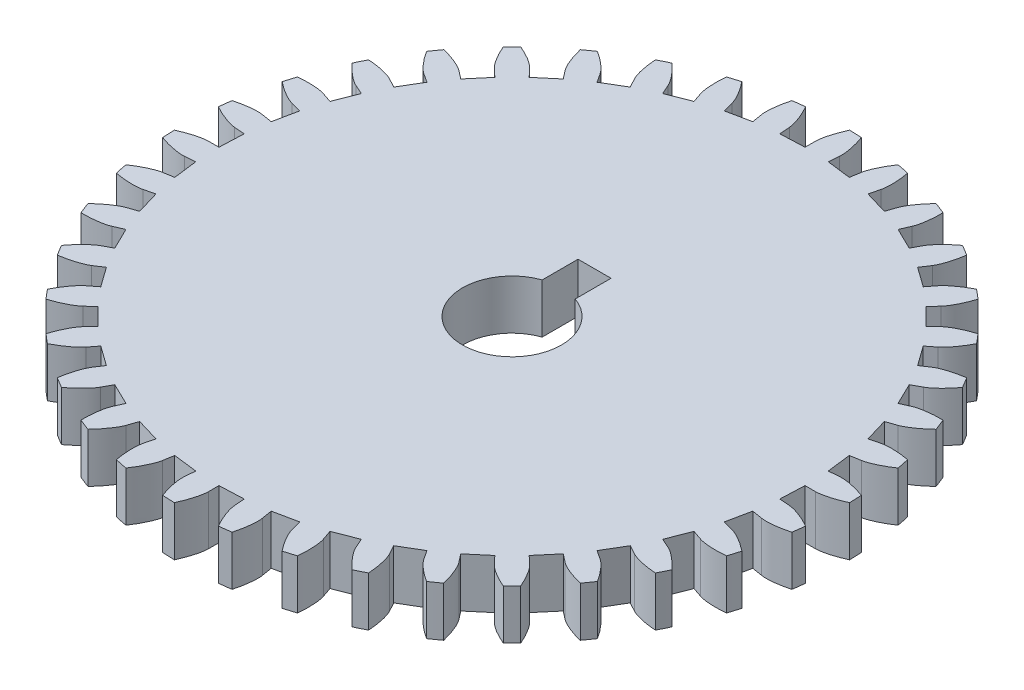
SolidWorks part; units mm, degrees
ref_plane "Front Plane" through (0, 0, 0) normal (0, 0, 1) x (1, 0, 0)
ref_plane "Top Plane" through (0, 0, 0) normal (0, 1, 0) x (1, 0, 0)
ref_plane "Right Plane" through (0, 0, 0) normal (1, 0, 0) x (0, 0, -1)
sketch "Sketch1" plane through (0, 0, 0) normal (0, 1, 0) x (1, 0, 0)
  line L0 (0, 0) -> (0, 9.1974) construction
  line L1 (0, 0) -> (-9.1974, 0) construction
  line L2 (0, 0) -> (-9.9915, -0.4132) construction
  line L3 (0, 0) -> (-9.166, -0.7595) construction
  line L4 (0, 0) -> (-9.072, -1.5138) construction
  circle A0 centre (0, 0) radius 9.5 construction
  circle A1 centre (0, 0) radius 9.1974 construction
  circle A2 centre (0, 0) radius 8.875 construction
  circle A3 centre (0, 0) radius 10 construction
  spline S0 degree 4 poles (-9.1974, 0) (-9.2115, 0) (-9.2511, -0.0015) (-9.3258, -0.0099) (-9.4463, -0.0319) (-9.5977, -0.0715) (-9.7896, -0.1361) (-10.0101, -0.2289) (-10.2453, -0.3479) (-10.4923, -0.4951) (-10.73, -0.6574) (-10.9582, -0.8327) (-11.177, -1.0196) (-11.4312, -1.259) (-11.7203, -1.5653) (-12.0337, -1.9464) (-12.3585, -2.409) (-12.6545, -2.9029) (-12.9165, -3.4154) (-13.1453, -3.9438) (-13.3417, -4.4846) (-13.4859, -4.9676) (-13.5903, -5.3856) (-13.6647, -5.7387) (-13.7167, -6.0191) (-13.7616, -6.3081) (-13.7989, -6.5849) (-13.8297, -6.8852) (-13.8522, -7.1471) (-13.8731, -7.5347) (-13.8791, -7.7673) (-13.8823, -8.1392) (-13.8752, -8.3184) (-13.8723, -8.4729) (-13.8693, -8.5146) (-13.8682, -8.5488) knots 0 0 0 0 0 0.005377 0.015084 0.028532 0.04661 0.064855 0.092111 0.119476 0.146842 0.174209 0.201575 0.228941 0.256307 0.307035 0.361767 0.4165 0.471232 0.525964 0.580697 0.635429 0.690161 0.717528 0.744894 0.77226 0.799626 0.826992 0.854358 0.881725 0.909091 0.954545 0.977273 0.988636 1 1 1 1 1 construction
  spline S1 degree 4 poles (-9.1974, 0) (-9.2115, 0) (-9.2511, -0.0015) (-9.3258, -0.0099) (-9.4463, -0.0319) (-9.5977, -0.0715) (-9.7896, -0.1361) (-10.0101, -0.2289) (-10.2453, -0.3479) (-10.4923, -0.4951) (-10.73, -0.6574) (-10.9582, -0.8327) (-11.177, -1.0196) (-11.4312, -1.259) (-11.7203, -1.5653) (-12.0337, -1.9464) (-12.3585, -2.409) (-12.6545, -2.9029) (-12.9165, -3.4154) (-13.1453, -3.9438) (-13.3417, -4.4846) (-13.4859, -4.9676) (-13.5903, -5.3856) (-13.6647, -5.7387) (-13.7167, -6.0191) (-13.7616, -6.3081) (-13.7989, -6.5849) (-13.8297, -6.8852) (-13.8522, -7.1471) (-13.8656, -7.3966) (-13.8712, -7.5286) (-13.8733, -7.5939) knots 0 0 0 0 0 0.005377 0.015084 0.028532 0.04661 0.064855 0.092111 0.119476 0.146842 0.174209 0.201575 0.228941 0.256307 0.307035 0.361767 0.4165 0.471232 0.525964 0.580697 0.635429 0.690161 0.717528 0.744894 0.77226 0.799626 0.826992 0.854358 0.881725 0.909091 0.909091 0.909091 0.909091 0.909091
  dimension "D1" = 20
  dimension "D2" = 19
  dimension "D3" = 18.3948
  dimension "D4" = 17.75
  dimension "D5" = 9.1974
  dimension "D6" = 2.368
  dimension "D7" = 4.737
  dimension "D8" = 9.474
sketch "Sketch2" plane through (0, 0, 0) normal (0, 1, 0) x (1, 0, 0)
  line L0 (0, 0) -> (-9.9915, -0.4132) construction
  line L1 (0, 0) -> (-9.9915, -0.4132) construction
  line L2 (0, 0) -> (-9.166, -0.7595) construction
  line L3 (0, 0) -> (-9.1974, 0) construction
  line L4 (0, 0) -> (-9.072, -1.5138) construction
  line L5 (0, 0) -> (-9.166, -0.7595) construction
  line L6 (0, 0) -> (-9.1974, 0) construction
  line L7 (0, 0) -> (-9.072, -1.5138) construction
  line L8 (-9.166, -0.7595) -> (-8.8447, -0.7329)
  line L9 (-8.8447, -0.7329) -> (-8.754, -1.4608)
  line L10 (-8.754, -1.4608) -> (-9.072, -1.5138) construction
  line L11 (-8.754, -1.4608) -> (-1.4795, -0.2469)
  line L12 (-9.1974, 0) -> (-1.5, 0)
  circle A0 centre (0, 0) radius 8.875 construction
  circle A1 centre (0, 0) radius 9.1974 construction
  circle A2 centre (0, 0) radius 9.5 construction
  circle A3 centre (0, 0) radius 10 construction
  circle A4 centre (0, 0) radius 8.875 construction
  circle A5 centre (0, 0) radius 9.1974 construction
  circle A6 centre (0, 0) radius 9.5 construction
  circle A7 centre (0, 0) radius 10 construction
  arc A8 (-9.982, -0.5991) -> (-9.9974, -0.2272) centre (0, 0) cw
  circle A11 centre (0, 0) radius 1.5 construction
  arc A12 (-1.5, 0) -> (-1.4795, -0.2469) centre (0, 0) ccw
  spline S0 degree 4 poles (-38.6469, -999.5523) (-6.9205, -22.0247) (-7.4023, -0.4759) (-8.465, 0.1466) (-9.4463, -0.0319) (-9.5977, -0.0715) (-9.7896, -0.1361) (-10.0101, -0.2289) (-10.2453, -0.3479) (-10.4923, -0.4951) (-10.73, -0.6574) (-10.9582, -0.8327) (-11.177, -1.0196) (-11.4312, -1.259) (-11.7203, -1.5653) (-12.0337, -1.9464) (-12.3585, -2.409) (-12.6545, -2.9029) (-12.9165, -3.4154) (-13.1453, -3.9438) (-13.3417, -4.4846) (-13.4859, -4.9676) (-13.5903, -5.3856) (-13.6647, -5.7387) (-13.7167, -6.0191) (-13.7616, -6.3081) (-13.7989, -6.5849) (-13.8297, -6.8852) (-13.9396, -8.1637) (-13.912, -11.3967) (-12.4976, 22.6301) (-46.3566, -1007.0303) knots -0.332755 -0.332755 -0.332755 -0.332755 -0.332755 0.005377 0.015084 0.028532 0.04661 0.064855 0.092111 0.119476 0.146842 0.174209 0.201575 0.228941 0.256307 0.307035 0.361767 0.4165 0.471232 0.525964 0.580697 0.635429 0.690161 0.717528 0.744894 0.77226 0.799626 0.826992 0.854358 0.881725 1.333918 1.333918 1.333918 1.333918 1.333918 only from (-9.1974, 0) to (-13.8733, -7.5939) construction
  spline S1 degree 4 poles (-9.1974, 0) (-9.2115, 0) (-9.2511, -0.0015) (-9.3258, -0.0099) (-9.4463, -0.0319) (-9.5977, -0.0715) (-9.7585, -0.1256) (-9.883, -0.1759) (-9.9622, -0.211) (-9.9974, -0.2272) knots 0 0 0 0 0 0.005377 0.015084 0.028532 0.04661 0.064855 0.079601 0.079601 0.079601 0.079601 0.079601
  spline S2 degree 4 poles (-9.166, -0.7595) (-9.1801, -0.7607) (-9.2197, -0.7625) (-9.2947, -0.7602) (-9.4167, -0.7483) (-9.5708, -0.7213) (-9.7355, -0.6806) (-9.8637, -0.6408) (-9.9456, -0.6124) (-9.982, -0.5991) knots 0 0 0 0 0 0.005377 0.015084 0.028532 0.04661 0.064855 0.079601 0.079601 0.079601 0.079601 0.079601
  point P21 (-8.8447, -0.7329)
  point P24 (-8.754, -1.4608)
  dimension "D2" = 3
extrude "Boss-Extrude1" add sketch "Sketch2" along normal blind 1.5
pattern_circular "CirPattern1" count 38 over 360 of "Boss-Extrude1"
sketch "Sketch3" plane through (0, 1.5, 0) normal (0, 1, 0) x (1, 0, 0)
  line L1 (0.5, 0.5) -> (-0.5, 0.5)
  line L2 (0.5, 0.5) -> (0.5, 2.5)
  line L3 (0.5, 2.5) -> (-0.5, 2.5)
  line L4 (-0.5, 0.5) -> (-0.5, 2.5)
  line L5 (0.5, 0.5) -> (-0.5, 2.5) construction
  line L6 (0.5, 2.5) -> (-0.5, 0.5) construction
  circle A0 centre (0, 0) radius 1.5 construction
  point P0 (0, 1.5)
  dimension "D1" = 2
  dimension "D2" = 1
extrude "Cut-Extrude1" cut sketch "Sketch3" against normal up to surface (1.5 mm away)
equation "\"Module\"= .5"
equation "\"Number of Teeth\"= 38"
equation "\"Pressure Angle\"= 14.5deg"
equation "\"Pitch Diameter\"= \"Number of Teeth\" * \"Module\""
equation "\"Circular Pitch\"= pi * \"Module\""
equation "\"Addendum\"= \"Module\""
equation "\"Dedendum\"= 1.25 * \"Module\""
equation "\"Base Diameter\"= \"Pitch Diameter\" * cos ( \"Pressure Angle\" )"
equation "\"Base Radius\"= \"Base Diameter\" / 2"
equation "\"Width\"= 1.5"
equation "\"Outside Diameter\"= \"Pitch Diameter\" + 2 * \"Addendum\""
equation "\"D1@Sketch1\"=\"Outside Diameter\""
equation "\"D3@Sketch1\"=\"Base Diameter\""
equation "\"Root Diameter\"= \"Pitch Diameter\" - 2 * \"Dedendum\""
equation "\"D4@Sketch1\"=\"Root Diameter\""
equation "\"Tooth Angle\"= 360 / \"Number of Teeth\""
equation "\"D6@Sketch1\"=\"Tooth Angle\"/4"
equation "\"D7@Sketch1\"=\"Tooth Angle\"/2"
equation "\"D8@Sketch1\"=\"Tooth Angle\""
equation "\"D2@Sketch1\" = \"Pitch Diameter\""
equation "\"Shaft Diameter\"= 3"
equation "\"D1@CirPattern1\" = \"Number of Teeth\""
equation "\"D2@Sketch2\"= \"Shaft Diameter\""
equation "\"D1@Boss-Extrude1\" = \"Width\""
